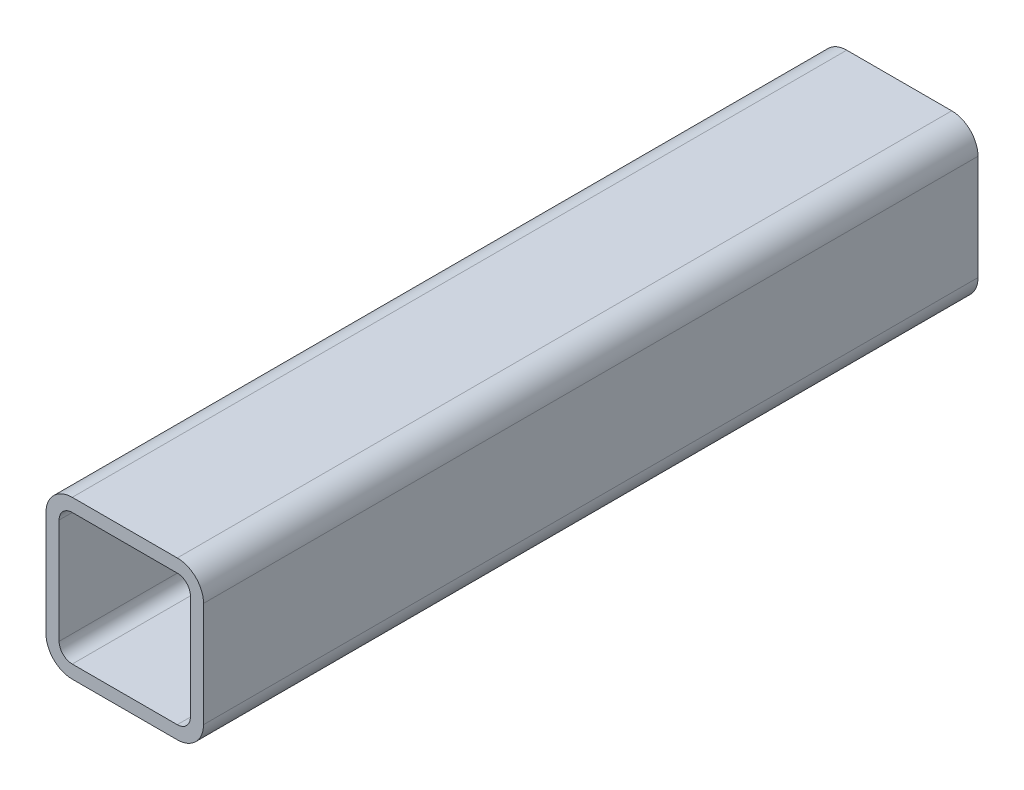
SolidWorks part; units mm, degrees
ref_plane "Front" through (0, 0, 0) normal (0, 0, 1) x (1, 0, 0)
ref_plane "Top" through (0, 0, 0) normal (0, 1, 0) x (1, 0, 0)
ref_plane "Right" through (0, 0, 0) normal (1, 0, 0) x (0, 0, -1)
sketch "Sketch1" plane through (0, 0, 0) normal (0, 0, 1) x (1, 0, 0)
  line L0 (-25.4, 38.1) -> (25.4, 38.1)
  line L1 (-38.1, 25.4) -> (-38.1, -25.4)
  line L2 (25.4, -38.1) -> (-25.4, -38.1)
  line L3 (38.1, -25.4) -> (38.1, 25.4)
  line L4 (0, -38.1) -> (0, 38.1) construction
  arc A0 (-38.1, 25.4) -> (-25.4, 38.1) centre (-25.4, 25.4) cw
  arc A1 (-25.4, -38.1) -> (-38.1, -25.4) centre (-25.4, -25.4) cw
  arc A2 (38.1, -25.4) -> (25.4, -38.1) centre (25.4, -25.4) cw
  arc A3 (38.1, 25.4) -> (25.4, 38.1) centre (25.4, 25.4) ccw
  dimension "D1" = 12.7
  dimension "D2" = 76.2
  dimension "D3" = 76.2
extrude "Base-Extrude-Thin" add sketch "Sketch1" along normal blind 374.65 thin
